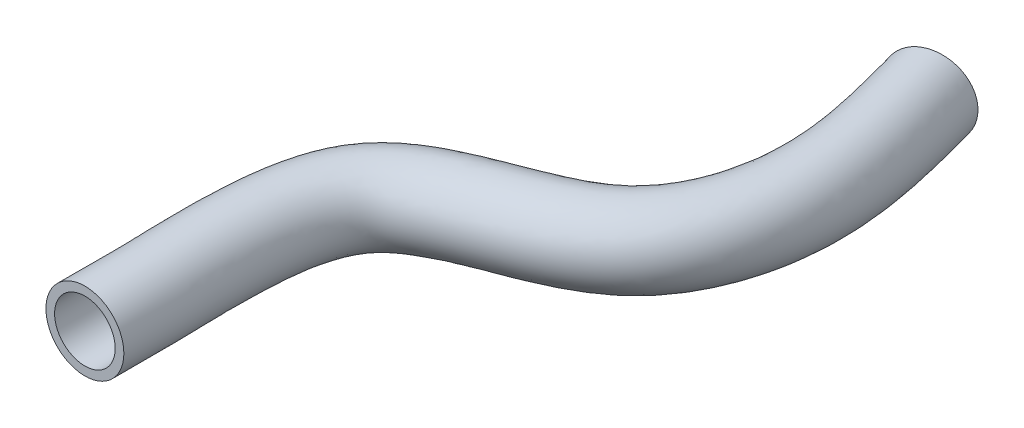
SolidWorks part; units mm, degrees
ref_plane "Face" through (0, 0, 0) normal (0, 0, 1) x (1, 0, 0)
ref_plane "Dessus" through (0, 0, 0) normal (0, 1, 0) x (1, 0, 0)
ref_plane "Droite" through (0, 0, 0) normal (1, 0, 0) x (0, 0, -1)
sketch "Esquisse1" plane through (0, 0, 0) normal (0, 0, 1) x (1, 0, 0)
  circle A0 centre (0, 0) radius 9
  circle A1 centre (0, 0) radius 7
  dimension "D1" = 18
  dimension "D2" = 14
sketch "Esquisse2" plane through (0, 0, 0) normal (0, 1, 0) x (1, 0, 0)
  spline S0 degree 3 poles (0, 0) (0.0275, 4.3054) (0.1085, 16.9622) (-0.8761, 35.9589) (3.965, 69.5069) (44.4932, 71.0522) (59.9785, 109.0542) (54.0299, 130.9944) (50.2398, 144.9734) knots 0 0 0 0 0.075113 0.22081 0.343336 0.610536 0.751856 1 1 1 1
sweep "Balayage1" add profiles "Esquisse1" path "Esquisse2"
